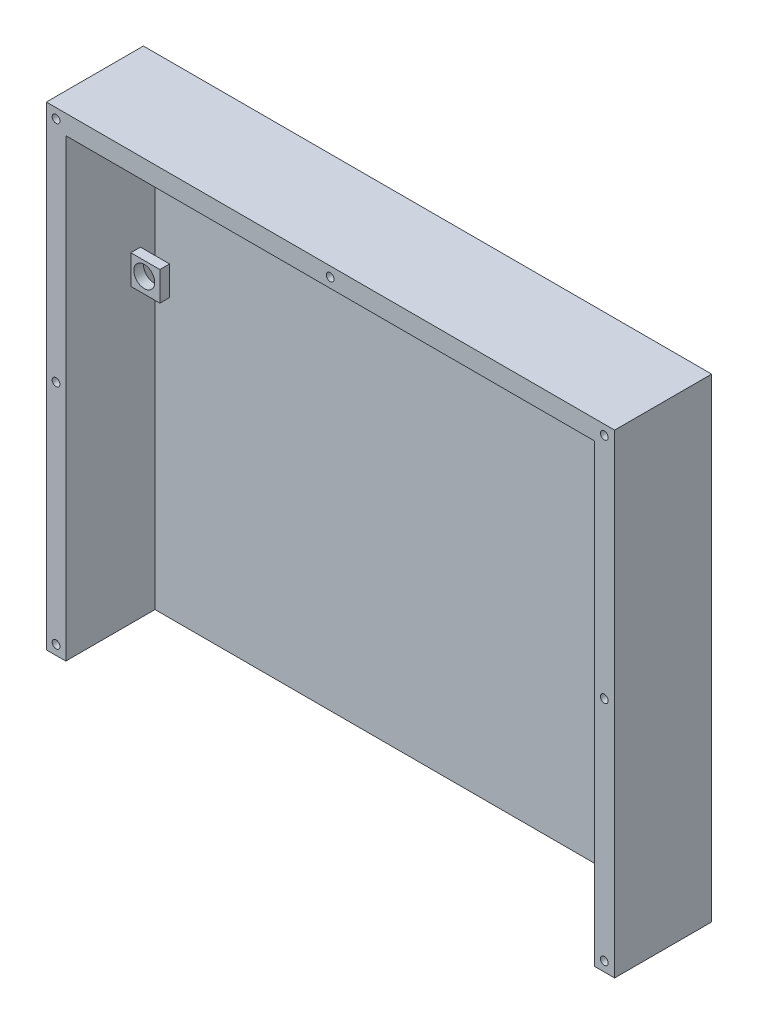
SolidWorks part; units mm, degrees
ref_plane "Front Plane" through (0, 0, 0) normal (0, 0, 1) x (1, 0, 0)
ref_plane "Top Plane" through (0, 0, 0) normal (0, 1, 0) x (1, 0, 0)
ref_plane "Right Plane" through (0, 0, 0) normal (1, 0, 0) x (0, 0, -1)
sketch "Sketch1" plane through (0, 0, 0) normal (0, 0, 1) x (1, 0, 0)
  line L1 (0, 0) -> (585.6337, 0)
  line L2 (0, 0) -> (0, 489)
  line L3 (0, 489) -> (585.6337, 489)
  line L4 (585.6337, 0) -> (585.6337, 489)
extrude "Boss-Extrude1" add sketch "Sketch1" along normal blind 100
sketch "Sketch2" plane through (0, 0, 100) normal (0, 0, 1) x (1, 0, 0)
  line L0 (0, 0) -> (585.6337, 0) construction
  line L1 (50, 469) -> (565, 469)
  line L2 (50, 469) -> (50, 0)
  line L3 (50, 0) -> (565, 0)
  line L4 (565, 469) -> (565, 0)
extrude "Cut-Extrude1" cut sketch "Sketch2" against normal blind 92
sketch "Sketch4" plane through (50, 0, 0) normal (1, 0, 0) x (0, 0, -1)
  line L0 (-8, 0) -> (-8, 469) construction
  line L1 (-100, 469) -> (-8, 469)
  line L2 (-100, 469) -> (-100, 331)
  line L3 (-100, 331) -> (-8, 331)
  line L4 (-8, 469) -> (-8, 331)
  line L5 (-100, 0) -> (-100, 489) construction
  line L6 (-100, 301) -> (-8, 301)
  line L7 (-100, 301) -> (-100, 0)
  line L8 (-100, 0) -> (-8, 0)
  line L9 (-8, 301) -> (-8, 0)
extrude "Base pivot cut 1" cut sketch "Sketch4" against normal blind 30
sketch "Sketch5" plane through (50, 0, 0) normal (1, 0, 0) x (0, 0, -1)
  line L0 (-100, 331) -> (-8, 331) construction
  line L1 (-23, 331) -> (-8, 331)
  line L2 (-23, 331) -> (-23, 301)
  line L3 (-23, 301) -> (-8, 301)
  line L4 (-8, 331) -> (-8, 301)
  line L5 (-8, 301) -> (-100, 301) construction
  line L6 (-100, 331) -> (-33, 331)
  line L7 (-100, 331) -> (-100, 301)
  line L8 (-100, 301) -> (-33, 301)
  line L9 (-33, 331) -> (-33, 301)
extrude "Base pivot cut 2 " cut sketch "Sketch5" against normal blind 30
sketch "Sketch6" plane through (0, 0, 33) normal (0, 0, 1) x (1, 0, 0)
  circle A0 centre (33.9116, 316.747) radius 10.7923
extrude "Base pivot cut 3" cut sketch "Sketch6" against normal blind 10
sketch "Sketch7" plane through (0, 0, 100) normal (0, 0, 1) x (1, 0, 0)
  circle A0 centre (10, 479) radius 4
  circle A1 centre (575, 479) radius 4
  circle A2 centre (10, 10) radius 4
  circle A3 centre (575, 10) radius 4
  circle A4 centre (10, 244) radius 4
  circle A5 centre (575, 244) radius 4
  circle A6 centre (292.5, 479) radius 4
extrude "Cut-Extrude6" cut sketch "Sketch7" against normal through all
sketch "Sketch8" plane through (0, 0, 0) normal (0, 0, -1) x (-1, 0, 0)
  circle A0 centre (-575, 479) radius 6
  circle A1 centre (-292.5, 479) radius 6
  circle A2 centre (-10, 479) radius 6
  circle A3 centre (-575, 244) radius 6
  circle A4 centre (-575, 10) radius 6
  circle A5 centre (-10, 244) radius 6
  circle A6 centre (-10, 10) radius 6
extrude "Cut-Extrude7" cut sketch "Sketch8" against normal blind 4
